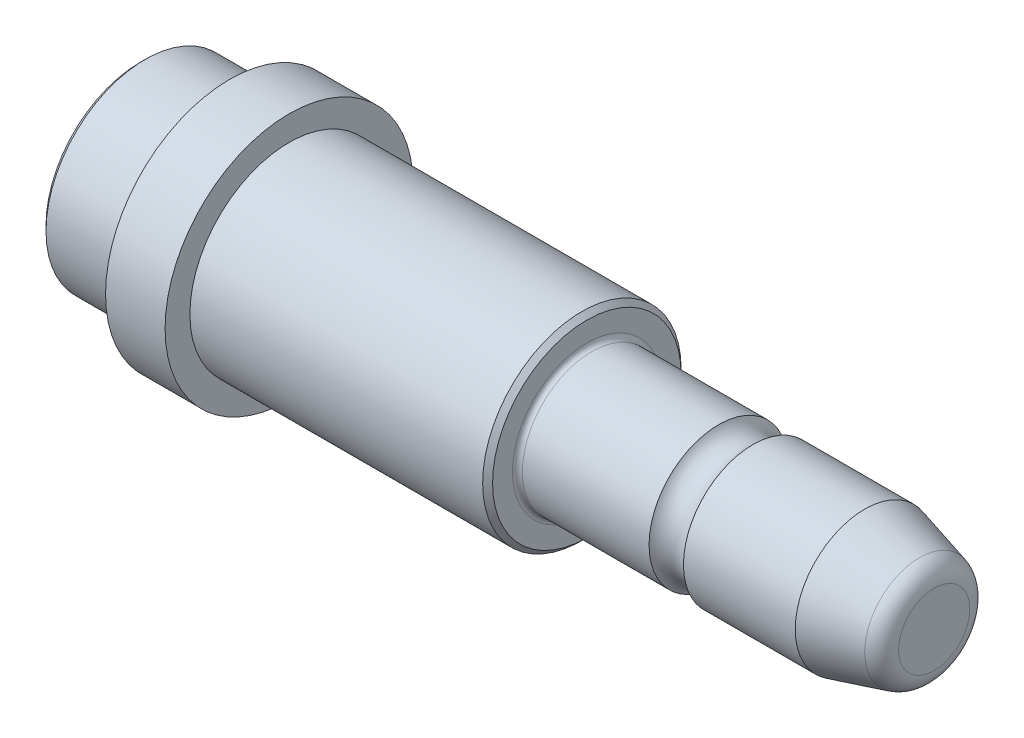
SolidWorks part; units mm, degrees
ref_plane "Face" through (0, 0, 0) normal (0, 0, 1) x (1, 0, 0)
ref_plane "Dessus" through (0, 0, 0) normal (0, 1, 0) x (1, 0, 0)
ref_plane "Droite" through (0, 0, 0) normal (1, 0, 0) x (0, 0, -1)
sketch "Esquisse1" plane through (0, 0, 0) normal (0, 0, 1) x (1, 0, 0)
  line L0 (9, 12.5) -> (15, 12.5)
  line L1 (15, 12.5) -> (15, 10)
  line L2 (15, 10) -> (45, 10)
  line L5 (45, 10) -> (45, 7)
  line L6 (45, 7) -> (58.2679, 7)
  line L7 (73, 7) -> (80, 5.1244)
  line L8 (80, 5.1244) -> (80, 0)
  line L9 (9, 12.5) -> (9, 10)
  line L10 (-12.9926, 0) -> (109.8887, 0) construction
  line L11 (9, 10) -> (0, 10)
  line L12 (61.7321, 7) -> (73, 7)
  line L13 (0, 10) -> (0, 0)
  line L14 (80, 0) -> (0, 0)
  arc A0 (58.2679, 7) -> (61.7321, 7) centre (60, 8) ccw
  dimension "D2" = 2
  dimension "D3" = 20
  dimension "D4" = 9
  dimension "D5" = 6
  dimension "D6" = 8
  dimension "D7" = 36
  dimension "D8" = 35
  dimension "D9" = 15
  dimension "D10" = 7
  dimension "D11" = 14
  dimension "D13" = 25
  dimension "D14" = 15
revolve "Base-Révolution" add sketch "Esquisse1" angle 360 about L10
chamfer "Chanfrein1" distance 0.5 angle 45 2 edges at (0, 0, 10) (45, 0, 10)
fillet "Congé1" radius 0.5 1 edges at (45, 0, 7)
fillet "Congé2" radius 2 1 edges at (80, 0, 5.1244)
